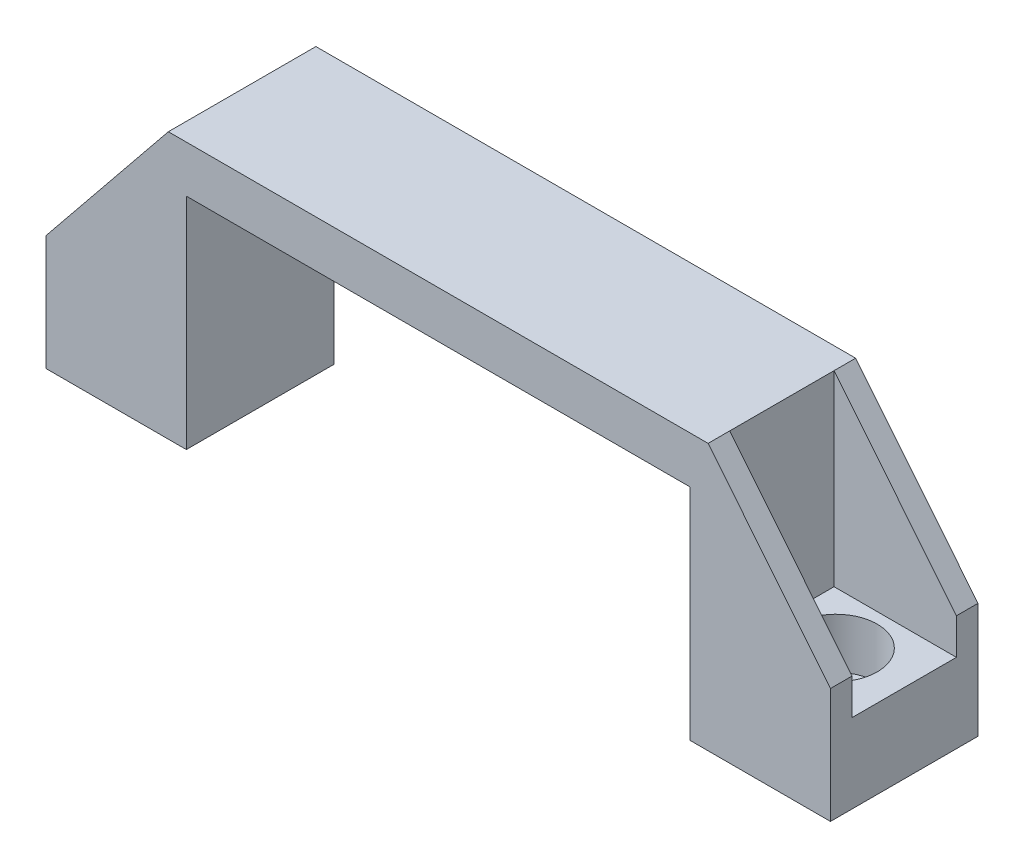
SolidWorks part; units mm, degrees
ref_plane "前视基准面" through (0, 0, 0) normal (0, 0, 1) x (1, 0, 0)
ref_plane "上视基准面" through (0, 0, 0) normal (0, 1, 0) x (1, 0, 0)
ref_plane "右视基准面" through (0, 0, 0) normal (1, 0, 0) x (0, 0, -1)
sketch "草图1" plane through (0, 0, 0) normal (0, 0, 1) x (1, 0, 0)
  line L0 (-54.5, 0) -> (-35, 0)
  line L1 (-35, 0) -> (-35, 30.5)
  line L2 (-35, 30.5) -> (35, 30.5)
  line L3 (35, 30.5) -> (35, 0)
  line L4 (35, 0) -> (54.5, 0)
  line L5 (54.5, 0) -> (54.5, 16)
  line L6 (54.5, 16) -> (37.5, 37)
  line L7 (37.5, 37) -> (-37.5, 37)
  line L8 (-37.5, 37) -> (-54.5, 16)
  line L9 (-54.5, 16) -> (-54.5, 0)
  dimension "D1" = 75
  dimension "D2" = 70
  dimension "D3" = 19.5
  dimension "D4" = 19.5
  dimension "D5" = 16
  dimension "D6" = 16
  dimension "D7" = 6.5
  dimension "D8" = 2.5
  dimension "D9" = 35
  dimension "D10" = 37
extrude "凸台-拉伸1" add sketch "草图1" along normal mid plane 20.5
sketch "草图2" plane through (0, 0, 0) normal (0, -1, 0) x (1, 0, 0)
  circle A0 centre (-45, 0) radius 3.25
  circle A1 centre (45, 0) radius 2.9951
  dimension "D1" = 6.5
  dimension "D2" = 45
  dimension "D3" = 90
extrude "切除-拉伸1" cut sketch "草图2" against normal through all
mirror "镜向1" about plane through (0, 0, 0) normal (1, 0, 0) of "切除-拉伸1"
sketch "草图3" plane through (0, 37, 0) normal (0, 1, 0) x (1, 0, 0)
  line L0 (-54.5, -10.25) -> (-54.5, 10.25) construction
  line L1 (-54.5, 7.25) -> (-37.5, 7.25)
  line L2 (-54.5, 7.25) -> (-54.5, -7.25)
  line L3 (-54.5, -7.25) -> (-37.5, -7.25)
  line L4 (-37.5, 7.25) -> (-37.5, -7.25)
  line L5 (-37.5, 10.25) -> (-54.5, 10.25) construction
  line L6 (-37.5, -10.25) -> (-54.5, -10.25) construction
  dimension "D1" = 3
  dimension "D2" = 3
  dimension "D3" = 17
extrude "切除-拉伸2" cut sketch "草图3" against normal blind 26
mirror "镜向2" about plane through (0, 0, 0) normal (1, 0, 0) of "切除-拉伸2"
sketch "草图4" plane through (0, 11, 0) normal (0, 1, 0) x (1, 0, 0)
  circle A0 centre (-45, 0) radius 5.75
  circle A1 centre (45, 0) radius 5.75
  dimension "D1" = 11.5
extrude "切除-拉伸3" cut sketch "草图4" against normal blind 7
